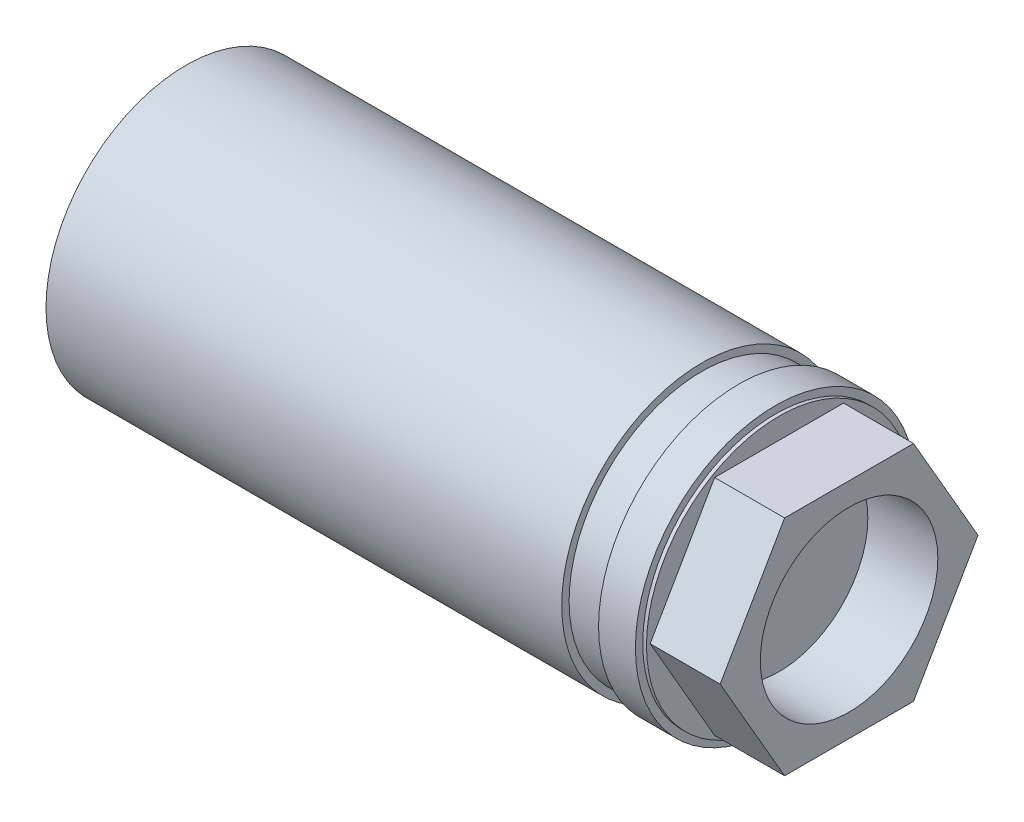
SolidWorks part; units mm, degrees
ref_plane "Alzado" through (0, 0, 0) normal (0, 0, 1) x (1, 0, 0)
ref_plane "Planta" through (0, 0, 0) normal (0, 1, 0) x (1, 0, 0)
ref_plane "Vista lateral" through (0, 0, 0) normal (1, 0, 0) x (0, 0, -1)
sketch "Croquis1" plane through (0, 0, 0) normal (0, 0, 1) x (1, 0, 0)
  line L0 (0, 0) -> (28.336, 0) construction
  line L1 (0, 0) -> (0, 19)
  line L2 (0, 19) -> (70, 19)
  line L3 (70, 19) -> (70, 18)
  line L4 (70, 18) -> (75, 18)
  line L5 (75, 18) -> (75, 19)
  line L6 (75, 19) -> (80, 19)
  line L7 (80, 19) -> (80, 18)
  line L8 (80, 18) -> (80.5, 18)
  line L9 (80.5, 18) -> (80.5, 0)
  line L10 (80.5, 0) -> (0, 0)
  dimension "D1" = 38
  dimension "D2" = 70
  dimension "D3" = 1
  dimension "D4" = 5
  dimension "D5" = 0.5
revolve "Revolución1" add sketch "Croquis1" angle 360 about L0
sketch "Croquis2" plane through (80.5, 0, 0) normal (1, 0, 0) x (0, 0, -1)
  line L1 (-8.7498, 15.1556) -> (-17.5, 0.0002)
  line L2 (-17.5, 0.0002) -> (-8.7502, -15.1553)
  line L3 (-8.7502, -15.1553) -> (8.7498, -15.1556)
  line L4 (8.7498, -15.1556) -> (17.5, -0.0002)
  line L5 (17.5, -0.0002) -> (8.7502, 15.1553)
  line L6 (8.7502, 15.1553) -> (-8.7498, 15.1556)
  circle A0 centre (0, 0) radius 15.1554 construction
  dimension "D1" = 35
extrude "Saliente-Extruir1" add sketch "Croquis2" along normal blind 9.5
sketch "Croquis3" plane through (90, 0, 0) normal (1, 0, 0) x (0, 0, -1)
  circle A0 centre (0, 0) radius 12.05
  dimension "D1" = 24.1
extrude "Cortar-Extruir1" cut sketch "Croquis3" against normal blind 9.5
